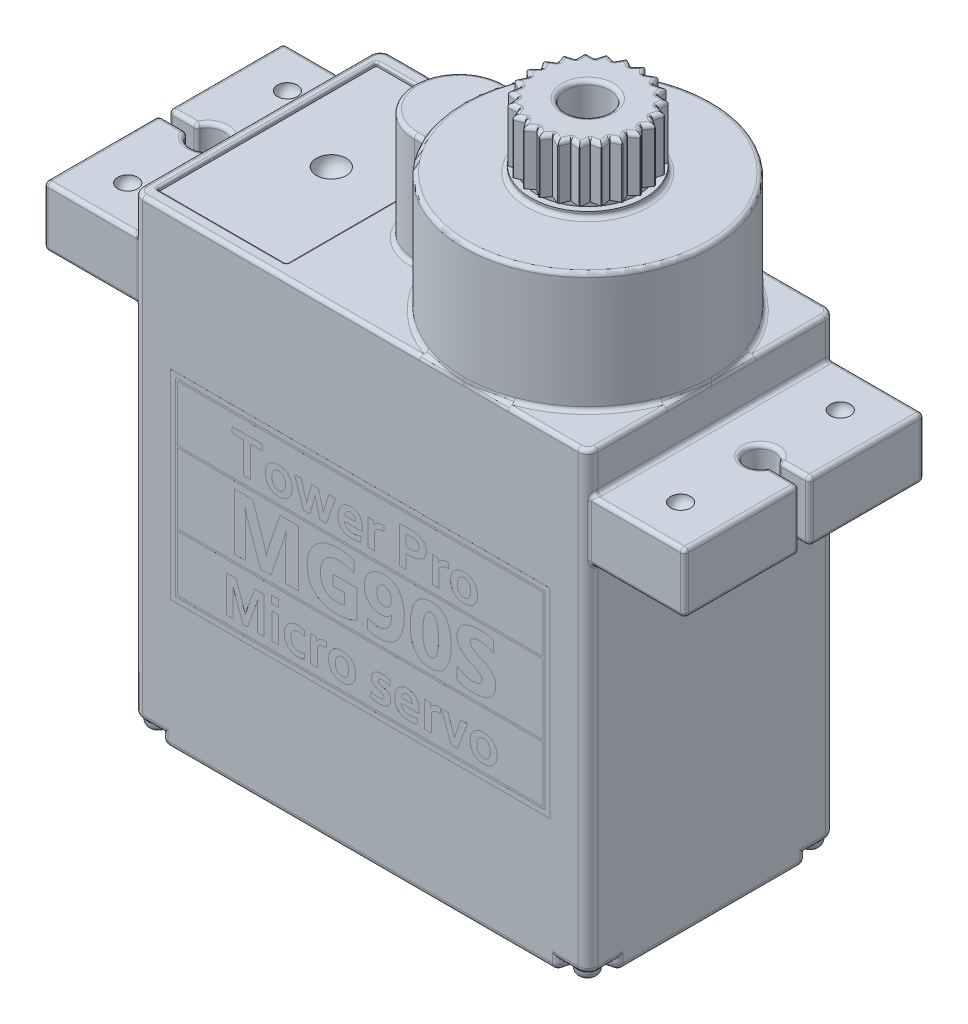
SolidWorks part; units mm, degrees
ref_plane "Plano frontal" through (0, 0, 0) normal (0, 0, 1) x (1, 0, 0)
ref_plane "Plano superior" through (0, 0, 0) normal (0, 1, 0) x (1, 0, 0)
ref_plane "Plano direito" through (0, 0, 0) normal (1, 0, 0) x (0, 0, -1)
sketch "Esboço1" plane through (0, 0, 0) normal (0, 1, 0) x (1, 0, 0)
  line L1 (-11.4, 6.2) -> (11.4, 6.2)
  line L2 (-11.4, 6.2) -> (-11.4, -6.2)
  line L3 (-11.4, -6.2) -> (11.4, -6.2)
  line L4 (11.4, 6.2) -> (11.4, -6.2)
  line L5 (-11.4, 6.2) -> (11.4, -6.2) construction
  line L6 (-11.4, -6.2) -> (11.4, 6.2) construction
  point P0 (0, 0)
  dimension "D1" = 22.8
  dimension "D2" = 12.4
extrude "Ressalto-extrusão1" add sketch "Esboço1" along normal blind 22.8
ref_plane "Plano1" through (0, 17.8, 0) normal (0, 1, 0) x (1, 0, 0)
sketch "Esboço3" plane through (0, 17.8, 0) normal (0, 1, 0) x (1, 0, 0)
  line L1 (-16.05, 6) -> (16.05, 6)
  line L2 (-16.05, 6) -> (-16.05, -6)
  line L3 (-16.05, -6) -> (16.05, -6)
  line L4 (16.05, 6) -> (16.05, -6)
  line L5 (-16.05, 6) -> (16.05, -6) construction
  line L6 (-16.05, -6) -> (16.05, 6) construction
  point P0 (0, 0)
  dimension "D1" = 32.1
  dimension "D2" = 12
extrude "Ressalto-extrusão2" add sketch "Esboço3" along normal blind 3
sketch "Esboço4" plane through (0, 22.8, 0) normal (0, 1, 0) x (1, 0, 0)
  line L4 (0, 0) -> (13.7593, 0) construction
  line L5 (-1.1595, -2.325) -> (-0.5476, -2.325)
  line L6 (-1.1595, 2.175) -> (-0.606, 2.175)
  line L7 (11.4, -6.2) -> (11.4, 6.2) construction
  line L8 (-11.4, -6.2) -> (11.4, -6.2) construction
  arc A2 (-1.1595, 2.175) -> (-1.1595, -2.325) centre (-1.1595, -0.075) ccw
  arc A3 (-0.5476, -2.325) -> (-0.606, 2.175) centre (5.2, 0) ccw
  dimension "D1" = 6.2
  dimension "D2" = 4.5
extrude "Ressalto-extrusão3" add sketch "Esboço4" along normal blind 6
sketch "Esboço5" plane through (0, 20.8, 0) normal (0, 1, 0) x (1, 0, 0)
  line L0 (0, 0) -> (0, 18.869) construction
  line L1 (-13.85, 0) -> (17.8281, 0) construction
  line L2 (-14.6438, 0.25) -> (-16.2215, 0.25)
  line L4 (-14.6438, -0.25) -> (-16.2215, -0.25)
  line L5 (-16.2215, 0.25) -> (-16.2215, -0.25)
  line L6 (-13.1431, 0.25) -> (-16.2215, -0.25) construction
  line L7 (-13.1431, -0.25) -> (-16.2215, 0.25) construction
  line L9 (14.5237, 0.25) -> (16.5205, 0.25)
  line L11 (14.5237, -0.25) -> (16.5205, -0.25)
  line L12 (16.5205, 0.25) -> (16.5205, -0.25)
  line L13 (14.0028, 0.25) -> (16.5205, -0.25) construction
  line L14 (14.0028, -0.25) -> (16.5205, 0.25) construction
  arc A0 (-14.6438, -0.25) -> (-14.6438, 0.25) centre (-13.85, 0) ccw
  arc A1 (14.5237, 0.25) -> (14.5237, -0.25) centre (13.85, 0) ccw
  point P1 (15.2616, 0)
  point P7 (-14.6823, 0)
  dimension "D1" = 27.7
  dimension "D2" = 0.5
  dimension "D3" = 0.5
extrude "Corte-extrusão1" cut sketch "Esboço5" against normal blind 7
sketch "Esboço6" plane through (0, 28.8, 0) normal (0, 1, 0) x (1, 0, 0)
  circle A0 centre (5.2, 0) radius 2.85
  dimension "D1" = 5.7
extrude "Ressalto-extrusão4" add sketch "Esboço6" along normal blind 0.5
sketch "Esboço7" plane through (0, 29.3, 0) normal (0, 1, 0) x (1, 0, 0)
  line L0 (5.2, 0) -> (5.2, 3.9708) construction
  line L1 (5.2, 2.8452) -> (5.222, 2.8452)
  line L2 (5.2, 2.8452) -> (5.178, 2.8452)
  line L3 (5.2, 0) -> (7.2989, 0) construction
  line L4 (5.178, 2.8452) -> (4.8598, 2.527)
  line L5 (5.222, 2.8452) -> (5.5402, 2.527)
  line L6 (5.9465, 2.7457) -> (5.5542, 2.5251)
  line L7 (5.9888, 2.7338) -> (6.2094, 2.3416)
  line L8 (5.9676, 2.7397) -> (5.9465, 2.7457)
  line L9 (5.9676, 2.7397) -> (5.9888, 2.7338)
  line L10 (6.6595, 2.4425) -> (6.2223, 2.3359)
  line L11 (6.6971, 2.4196) -> (6.8037, 1.9824)
  line L12 (6.6783, 2.431) -> (6.6595, 2.4425)
  line L13 (6.6783, 2.431) -> (6.6971, 2.4196)
  line L14 (7.2644, 1.9581) -> (6.8147, 1.9735)
  line L15 (7.2944, 1.926) -> (7.2791, 1.4762)
  line L16 (7.2794, 1.942) -> (7.2644, 1.9581)
  line L17 (7.2794, 1.942) -> (7.2944, 1.926)
  line L18 (7.7161, 1.3285) -> (7.2872, 1.4647)
  line L19 (7.7364, 1.2895) -> (7.6002, 0.8605)
  line L20 (7.7262, 1.309) -> (7.7161, 1.3285)
  line L21 (7.7262, 1.309) -> (7.7364, 1.2895)
  line L22 (7.9813, 0.6004) -> (7.605, 0.8472)
  line L23 (7.9902, 0.5573) -> (7.7434, 0.1811)
  line L24 (7.9857, 0.5789) -> (7.9813, 0.6004)
  line L25 (7.9857, 0.5789) -> (7.9902, 0.5573)
  line L26 (8.0401, -0.1722) -> (7.7444, 0.167)
  line L27 (8.0371, -0.2161) -> (7.6979, -0.5119)
  line L28 (8.0386, -0.1942) -> (8.0401, -0.1722)
  line L29 (8.0386, -0.1942) -> (8.0371, -0.2161)
  line L30 (7.8883, -0.9321) -> (7.6951, -0.5257)
  line L31 (7.8736, -0.9735) -> (7.4672, -1.1668)
  line L32 (7.881, -0.9528) -> (7.8883, -0.9321)
  line L33 (7.881, -0.9528) -> (7.8736, -0.9735)
  line L34 (7.5372, -1.6228) -> (7.4607, -1.1794)
  line L35 (7.5118, -1.6588) -> (7.0683, -1.7352)
  line L36 (7.5245, -1.6408) -> (7.5372, -1.6228)
  line L37 (7.5245, -1.6408) -> (7.5118, -1.6588)
  line L38 (7.0127, -2.1932) -> (7.0587, -1.7456)
  line L39 (6.9785, -2.221) -> (6.5309, -2.175)
  line L40 (6.9956, -2.2071) -> (7.0127, -2.1932)
  line L41 (6.9956, -2.2071) -> (6.9785, -2.221)
  line L42 (6.3537, -2.6009) -> (6.5188, -2.1823)
  line L43 (6.3134, -2.6185) -> (5.8947, -2.4534)
  line L44 (6.3335, -2.6097) -> (6.3537, -2.6009)
  line L45 (6.3335, -2.6097) -> (6.3134, -2.6185)
  line L46 (5.6092, -2.8157) -> (5.8811, -2.4572)
  line L47 (5.5656, -2.8217) -> (5.2071, -2.5498)
  line L48 (5.5874, -2.8187) -> (5.6092, -2.8157)
  line L49 (5.5874, -2.8187) -> (5.5656, -2.8217)
  line L50 (4.8344, -2.8217) -> (5.1929, -2.5498)
  line L51 (4.7908, -2.8157) -> (4.5189, -2.4572)
  line L52 (4.8126, -2.8187) -> (4.8344, -2.8217)
  line L53 (4.8126, -2.8187) -> (4.7908, -2.8157)
  line L54 (4.0866, -2.6185) -> (4.5053, -2.4534)
  line L55 (4.0463, -2.6009) -> (3.8812, -2.1823)
  line L56 (4.0665, -2.6097) -> (4.0866, -2.6185)
  line L57 (4.0665, -2.6097) -> (4.0463, -2.6009)
  line L58 (3.4215, -2.221) -> (3.8691, -2.175)
  line L59 (3.3873, -2.1932) -> (3.3413, -1.7456)
  line L60 (3.4044, -2.2071) -> (3.4215, -2.221)
  line L61 (3.4044, -2.2071) -> (3.3873, -2.1932)
  line L62 (2.8882, -1.6588) -> (3.3317, -1.7352)
  line L63 (2.8628, -1.6228) -> (2.9393, -1.1794)
  line L64 (2.8755, -1.6408) -> (2.8882, -1.6588)
  line L65 (2.8755, -1.6408) -> (2.8628, -1.6228)
  line L66 (2.5264, -0.9735) -> (2.9328, -1.1668)
  line L67 (2.5117, -0.9321) -> (2.7049, -0.5257)
  line L68 (2.519, -0.9528) -> (2.5264, -0.9735)
  line L69 (2.519, -0.9528) -> (2.5117, -0.9321)
  line L70 (2.3629, -0.2161) -> (2.7021, -0.5119)
  line L71 (2.3599, -0.1722) -> (2.6556, 0.167)
  line L72 (2.3614, -0.1942) -> (2.3629, -0.2161)
  line L73 (2.3614, -0.1942) -> (2.3599, -0.1722)
  line L74 (2.4098, 0.5573) -> (2.6566, 0.1811)
  line L75 (2.4187, 0.6004) -> (2.795, 0.8472)
  line L76 (2.4143, 0.5789) -> (2.4098, 0.5573)
  line L77 (2.4143, 0.5789) -> (2.4187, 0.6004)
  line L78 (2.6636, 1.2895) -> (2.7998, 0.8605)
  line L79 (2.6839, 1.3285) -> (3.1128, 1.4647)
  line L80 (2.6738, 1.309) -> (2.6636, 1.2895)
  line L81 (2.6738, 1.309) -> (2.6839, 1.3285)
  line L82 (3.1056, 1.926) -> (3.1209, 1.4762)
  line L83 (3.1356, 1.9581) -> (3.5853, 1.9735)
  line L84 (3.1206, 1.942) -> (3.1056, 1.926)
  line L85 (3.1206, 1.942) -> (3.1356, 1.9581)
  line L86 (3.7029, 2.4196) -> (3.5963, 1.9824)
  line L87 (3.7405, 2.4425) -> (4.1777, 2.3359)
  line L88 (3.7217, 2.431) -> (3.7029, 2.4196)
  line L89 (3.7217, 2.431) -> (3.7405, 2.4425)
  line L90 (4.4112, 2.7338) -> (4.1906, 2.3416)
  line L91 (4.4535, 2.7457) -> (4.8458, 2.5251)
  line L92 (4.4324, 2.7397) -> (4.4112, 2.7338)
  line L93 (4.4324, 2.7397) -> (4.4535, 2.7457)
  circle A1 centre (5.2, 0) radius 1.1
  arc A2 (2.7021, -0.5119) -> (2.7049, -0.5257) centre (5.2, 0) ccw
  arc A3 (2.6566, 0.1811) -> (2.6556, 0.167) centre (5.2, 0) ccw
  arc A4 (2.7998, 0.8605) -> (2.795, 0.8472) centre (5.2, 0) ccw
  arc A5 (4.8598, 2.527) -> (4.8458, 2.5251) centre (5.2, 0) ccw
  arc A6 (5.5542, 2.5251) -> (5.5402, 2.527) centre (5.2, 0) ccw
  arc A7 (6.2223, 2.3359) -> (6.2094, 2.3416) centre (5.2, 0) ccw
  arc A8 (6.8147, 1.9735) -> (6.8037, 1.9824) centre (5.2, 0) ccw
  arc A9 (7.2872, 1.4647) -> (7.2791, 1.4762) centre (5.2, 0) ccw
  arc A10 (7.605, 0.8472) -> (7.6002, 0.8605) centre (5.2, 0) ccw
  arc A11 (7.7444, 0.167) -> (7.7434, 0.1811) centre (5.2, 0) ccw
  arc A12 (7.6951, -0.5257) -> (7.6979, -0.5119) centre (5.2, 0) ccw
  arc A13 (7.4607, -1.1794) -> (7.4672, -1.1668) centre (5.2, 0) ccw
  arc A14 (7.0587, -1.7456) -> (7.0683, -1.7352) centre (5.2, 0) ccw
  arc A15 (6.5188, -2.1823) -> (6.5309, -2.175) centre (5.2, 0) ccw
  arc A16 (5.8811, -2.4572) -> (5.8947, -2.4534) centre (5.2, 0) ccw
  arc A17 (5.1929, -2.5498) -> (5.2071, -2.5498) centre (5.2, 0) ccw
  arc A18 (4.5053, -2.4534) -> (4.5189, -2.4572) centre (5.2, 0) ccw
  arc A19 (3.8691, -2.175) -> (3.8812, -2.1823) centre (5.2, 0) ccw
  arc A20 (3.3317, -1.7352) -> (3.3413, -1.7456) centre (5.2, 0) ccw
  arc A21 (2.9328, -1.1668) -> (2.9393, -1.1794) centre (5.2, 0) ccw
  arc A22 (4.1906, 2.3416) -> (4.1777, 2.3359) centre (5.2, 0) ccw
  arc A23 (3.5963, 1.9824) -> (3.5853, 1.9735) centre (5.2, 0) ccw
  arc A24 (3.1209, 1.4762) -> (3.1128, 1.4647) centre (5.2, 0) ccw
  dimension "D1" = 2.2
  dimension "D2" = 23
  dimension "D3" = 0.022
  dimension "D4" = 2.8452
  dimension "D5" = 0.45
  dimension "D7" = 90
extrude "Ressalto-extrusão5" add sketch "Esboço7" along normal blind 2.7
sketch "Esboço8" plane through (0, 29.3, 0) normal (0, 1, 0) x (1, 0, 0)
  circle A0 centre (5.2, 0) radius 2.5498
  circle A1 centre (5.2, 0) radius 2.85 construction
  circle A2 centre (5.2, 0) radius 2.85
extrude "Corte-extrusão2" cut sketch "Esboço8" against normal blind 0.2
sketch "Esboço9" plane through (0, 28.8, 0) normal (0, 1, 0) x (1, 0, 0)
  line L0 (-1.1595, -2.325) -> (-0.5476, -2.325) construction
  line L1 (-0.606, 2.175) -> (-1.1595, 2.175) construction
  line L2 (-1.1595, -2.325) -> (-0.5476, -2.325)
  line L3 (-0.606, 2.175) -> (-1.1595, 2.175)
  arc A0 (-0.606, 2.175) -> (-0.5476, -2.325) centre (5.2, 0) ccw
  arc A1 (-1.1595, 2.175) -> (-1.1595, -2.325) centre (-1.1595, -0.075) ccw construction
  arc A2 (-1.1595, 2.175) -> (-1.1595, -2.325) centre (-1.1595, -0.075) ccw
extrude "Corte-extrusão3" cut sketch "Esboço9" against normal blind 0.4
sketch "Esboço10" plane through (0, 0, 0) normal (0, -1, 0) x (1, 0, 0)
  line L4 (11.4, -6.2) -> (11.4, 6.2)
  line L5 (11.4, 6.2) -> (-11.4, 6.2)
  line L6 (-11.4, 6.2) -> (-11.4, -6.2)
  line L7 (-11.4, -6.2) -> (11.4, -6.2)
  line L8 (11.4, -4.7) -> (11.4, 4.7)
  line L9 (9.9, 6.2) -> (-9.9, 6.2)
  line L10 (-11.4, 4.7) -> (-11.4, -4.7)
  line L11 (-9.9, -6.2) -> (9.9, -6.2)
  arc A0 (-11.4, 4.7) -> (-9.9, 6.2) centre (-11.4, 6.2) ccw
  arc A1 (-9.9, -6.2) -> (-11.4, -4.7) centre (-11.4, -6.2) ccw
  arc A2 (11.4, -4.7) -> (9.9, -6.2) centre (11.4, -6.2) ccw
  arc A3 (9.9, 6.2) -> (11.4, 4.7) centre (11.4, 6.2) ccw
  dimension "D1" = 3
  dimension "D2" = 3
  dimension "D3" = 3
  dimension "D4" = 3
  dimension "D5" = 0
extrude "Ressalto-extrusão6" add sketch "Esboço10" along normal blind 0.5
sketch "Esboço11" plane through (0, 22.8, 0) normal (0, 1, 0) x (1, 0, 0)
  line L0 (0, 0) -> (-21.6987, 0) construction
  line L1 (-4.4, 5.5) -> (-10.9, 5.5)
  line L2 (-4.4, 5.5) -> (-4.4, -5.5)
  line L3 (-4.4, -5.5) -> (-10.9, -5.5)
  line L4 (-10.9, 5.5) -> (-10.9, -5.5)
  line L5 (-4.4, 5.5) -> (-10.9, -5.5) construction
  line L6 (-4.4, -5.5) -> (-10.9, 5.5) construction
  line L7 (-11.4, 6.2) -> (-11.4, -6.2) construction
  point P0 (-7.65, 0)
  dimension "D1" = 6.5
  dimension "D2" = 0.5
  dimension "D3" = 11
extrude "Corte-extrusão5" cut sketch "Esboço11" against normal blind 0.2
sketch "Esboço12" plane through (0, 22.6, 0) normal (0, 1, 0) x (1, 0, 0)
  line L0 (-4.4, -5.5) -> (-4.4, 5.5) construction
  line L1 (-10.9, -5.5) -> (-4.4, -5.5) construction
  line L2 (-5.1466, 0) -> (-9.5067, 0) construction
  line L3 (-8.4, 0) -> (-6.9, 0)
  arc A0 (-8.4, 0) -> (-6.9, 0) centre (-7.65, 0) ccw
  dimension "D1" = 1.5
  dimension "D2" = 3.25
  dimension "D3" = 5.5
revolve "Corte-Revolução1" cut sketch "Esboço12" angle 360 about L2
sketch "Esboço13" plane through (0, 20.8, 0) normal (0, 1, 0) x (1, 0, 0)
  line L0 (-13.85, 0) -> (-13.85, -5.7142) construction
  line L1 (-13.85, 0) -> (-13.85, 3.0965) construction
  line L2 (-11.4, 6) -> (-16.05, 6) construction
  line L3 (-13.85, 0) -> (-18.9376, 0) construction
  line L4 (-13.85, 3.0965) -> (-13.85, 5.8446) construction
  line L5 (-13.85, 4.5) -> (-13.85, 3.5)
  line L6 (-13.85, -3.5) -> (-13.85, -4.5)
  arc A0 (-13.85, 4.5) -> (-13.85, 3.5) centre (-13.85, 4) ccw
  arc A1 (-13.85, -4.5) -> (-13.85, -3.5) centre (-13.85, -4) cw
  dimension "D2" = 0.5
  dimension "D1" = 2
revolve "Corte-Revolução2" cut sketch "Esboço13" angle 360 about L1
mirror "Espelhar1" about plane through (0, 0, 0) normal (1, 0, 0) of "Corte-Revolução2"
fillet "Filete1" radius 0.5 4 edges at (-11.4, 11.4, -6.2) (-11.4, 11.4, 6.2) (11.4, 11.4, 6.2) (11.4, 11.4, -6.2)
fillet "Filete2" radius 0.3 28 edges at (-10.4, 0, -6.2) (-11.2536, 0, -6.0536) (-11.4, 0, 5.2) (-11.2536, 0, 6.0536) (10.4, 0, 6.2) (11.2536, 0, 6.0536) (11.4, 0, -5.2) (11.2536, 0, -6.0536) (-11.4, -0.5, 0) (-10.3393, -0.5, 5.1393) (0, -0.5, 6.2) (10.3393, -0.5, 5.1393) (11.4, -0.5, 0) (10.3393, -0.5, -5.1393) (0, -0.5, -6.2) (-10.3393, -0.5, -5.1393) (-11.4, 0, -5.2) (-10.4, 0, 6.2) (11.4, 0, 5.2) (10.4, 0, -6.2) (-9.9, -0.25, 6.2) (-11.4, -0.25, 4.7) (-11.4, -0.25, -4.7) (-9.9, -0.25, -6.2) (9.9, -0.25, -6.2) (11.4, -0.25, -4.7) (11.4, -0.25, 4.7) (9.9, -0.25, 6.2)
fillet "Filete3" radius 0.2 56 edges at (-11.3743, 20.8, -5.8581) (-11.3743, 20.8, 5.8581) (-13.675, 20.8, 6) (-11.3, 19.3, 6) (-11.3, 19.3, -6) (-13.675, 20.8, -6) (-13.675, 17.8, 6) (-11.3743, 17.8, 5.8581) (-11.4, 17.8, 0) (-11.3743, 17.8, -5.8581) (-13.675, 17.8, -6) (-15.3469, 17.8, 0.25) (-15.3469, 20.8, 0.25) (-15.3469, 20.8, -0.25) (-15.3469, 17.8, -0.25) (-13.0177, 17.8, 0) (-14.6438, 19.3, -0.25) (-13.0177, 20.8, 0) (-14.6438, 19.3, 0.25) (-16.05, 19.3, 6) (-16.05, 17.8, 3.125) (-16.05, 19.3, 0.25) (-16.05, 20.8, 3.125) (-16.05, 19.3, -6) (-16.05, 20.8, -3.125) (-16.05, 19.3, -0.25) (-16.05, 17.8, -3.125) (-11.4, 20.8, 0) (11.4, 20.8, 0) (11.3743, 20.8, 5.8581) (11.3743, 20.8, -5.8581) (16.05, 19.3, 6) (11.3, 19.3, 6) (16.05, 19.3, -6) (11.3, 19.3, -6) (11.3743, 17.8, -5.8581) (11.4, 17.8, 0) (11.3743, 17.8, 5.8581) (16.05, 17.8, 3.125) (15.2868, 17.8, 0.25) (13.1314, 17.8, 0) (15.2868, 17.8, -0.25) (16.05, 17.8, -3.125) (15.2868, 20.8, 0.25) (15.2868, 20.8, -0.25) (14.5237, 19.3, 0.25) (13.1314, 20.8, 0) (14.5237, 19.3, -0.25) (13.675, 20.8, -6) (13.675, 17.8, -6) (13.675, 17.8, 6) (13.675, 20.8, 6) (16.05, 19.3, -0.25) (16.05, 20.8, -3.125) (16.05, 20.8, 3.125) (16.05, 19.3, 0.25)
fillet "Filete4" radius 0.2 26 edges at (11.4, 22.8, -2.85) (-2.85, 22.8, -6.2) (8.05, 22.8, 6.2) (9.5841, 22.8, 4.3841) (1.6676, 22.8, -5.0953) (9.5841, 22.8, -4.3841) (-3.4095, 22.8, 0.075) (-0.8535, 22.8, 2.325) (1.7341, 22.8, 5.1408) (-0.8827, 22.8, -2.175) (5.2, 28.8, 6.2) (-0.606, 25.6, -2.175) (-0.5476, 25.6, 2.325) (-3.4095, 28.4, 0.075) (-0.8827, 28.4, -2.175) (-0.9995, 28.4, 0.0805) (-0.8535, 28.4, 2.325) (-11.4, 22.8, 0) (8.05, 22.8, -6.2) (-2.85, 22.8, 6.2) (-11.2536, 22.8, 6.0536) (-11.2536, 22.8, -6.0536) (11.4, 22.8, 2.85) (11.2536, 22.8, 6.0536) (11.2536, 22.8, -6.0536) (5.2, 28.8, 2.85)
fillet "Filete5" radius 0.1 8 edges at (-10.9, 22.8, 0) (-7.65, 22.8, 5.5) (-7.65, 22.8, -5.5) (-4.4, 22.8, 0) (-10.9, 22.7, 5.5) (-4.4, 22.7, 5.5) (-10.9, 22.7, -5.5) (-4.4, 22.7, -5.5)
sketch "Esboço15" plane through (0, 0, 6.2) normal (0, 0, 1) x (1, 0, 0)
  line L0 (0, -0.2) -> (0, 20.813) construction
  line L1 (-9.6252, -0.2) -> (9.6252, -0.2) construction
  line L2 (-15.85, 18) -> (-11.3899, 18) construction
  line L3 (-9.5, 16) -> (9.5, 16)
  line L4 (-9.5, 16) -> (-9.5, 6)
  line L5 (-9.5, 6) -> (9.5, 6)
  line L6 (9.5, 16) -> (9.5, 6)
  line L7 (-9.5, 16) -> (9.5, 6) construction
  line L8 (-9.5, 6) -> (9.5, 16) construction
  point P4 (0, 11)
  dimension "D1" = 2
  dimension "D2" = 19
  dimension "D3" = 10
extrude "Ressalto-extrusão8" add sketch "Esboço15" along normal blind 0.001
sketch "Esboço16" plane through (0, 0, 6.201) normal (0, 0, 1) x (1, 0, 0)
  line L0 (0, 0) -> (0, 21.6518) construction
  line L1 (-10.3224, 11) -> (10.3224, 11) construction
  line L2 (-9.15, 9.15) -> (-9.15, 6.35)
  line L3 (-9.25, 15.75) -> (9.25, 15.75)
  line L4 (-9.25, 15.75) -> (-9.25, 6.25)
  line L5 (-9.25, 6.25) -> (9.25, 6.25)
  line L6 (9.5, 6) -> (9.5, 16)
  line L7 (9.5, 16) -> (-9.5, 16)
  line L8 (-9.5, 16) -> (-9.5, 6)
  line L9 (-9.5, 6) -> (9.5, 6)
  line L10 (9.5, 6) -> (9.5, 16) construction
  line L11 (9.5, 16) -> (-9.5, 16) construction
  line L12 (-9.5, 16) -> (-9.5, 6) construction
  line L13 (-9.5, 6) -> (9.5, 6) construction
  line L14 (9.25, 15.75) -> (9.25, 6.25)
  line L15 (-9.25, 15.75) -> (9.25, 6.25) construction
  line L16 (-9.25, 6.25) -> (9.25, 15.75) construction
  line L17 (-9.15, 15.65) -> (9.15, 15.65)
  line L18 (-9.15, 15.65) -> (-9.15, 12.85)
  line L19 (-9.15, 6.35) -> (9.15, 6.35)
  line L20 (9.15, 15.65) -> (9.15, 12.85)
  line L21 (-9.15, 15.65) -> (9.15, 6.35) construction
  line L22 (-9.15, 6.35) -> (9.15, 15.65) construction
  line L23 (-9.15, 12.85) -> (9.15, 12.85)
  line L24 (-9.25, 12.85) -> (-9.25, 12.75)
  line L25 (-9.15, 12.75) -> (9.15, 12.75)
  line L26 (9.25, 12.85) -> (9.25, 12.75)
  line L27 (-9.15, 9.25) -> (9.15, 9.25)
  line L28 (-9.25, 9.25) -> (-9.25, 9.15)
  line L29 (-9.15, 9.15) -> (9.15, 9.15)
  line L30 (9.25, 9.25) -> (9.25, 9.15)
  line L31 (-9.15, 12.75) -> (-9.15, 9.25)
  line L32 (9.15, 12.75) -> (9.15, 9.25)
  line L33 (9.15, 9.15) -> (9.15, 6.35)
  point P7 (0, 11)
  point P15 (0, 11)
  dimension "D2" = 18.5
  dimension "D3" = 9.5
  dimension "D4" = 0.1
  dimension "D5" = 0.1
  dimension "D6" = 0.1
  dimension "D7" = 0.1
  dimension "D8" = 3.5
  dimension "D1" = 0
extrude "Corte-extrusão6" cut sketch "Esboço16" against normal blind 0.0001 contours L14 L3 L4 L5 L23 L18 L17 L20 L25 L32 L27 L31 L29 L33 L19 L2
sketch "Esboço17" plane through (0, 0, 6.201) normal (0, 0, 1) x (1, 0, 0)
  text T0 "MG90S" font "Gadugi" height in points 11
extrude "Corte-extrusão7" cut sketch "Esboço17" against normal blind 0.0001
sketch "Esboço18" plane through (0, 0, 6.201) normal (0, 0, 1) x (1, 0, 0)
  text T0 "Micro servo" font "Corbel" height in points 7
extrude "Ressalto-extrusão9" add sketch "Esboço18" along normal blind 0.0001
fillet "Filete7" radius 0.2 70 edges at (5.2, 32, 1.1) (5.3811, 32, -2.6861) (5.5472, 32, -2.5261) (5.7503, 32, -2.6354) (6.0991, 32, -2.5377) (6.2159, 32, -2.3387) (6.4409, 32, -2.3892) (6.7504, 32, -2.201) (6.8092, 32, -1.9779) (7.0395, 32, -1.9658) (7.2867, 32, -1.7011) (7.2831, 32, -1.4704) (7.5017, 32, -1.3966) (7.6683, 32, -1.075) (7.6026, 32, -0.8539) (7.7931, 32, -0.7238) (7.8668, 32, -0.3692) (7.7439, 32, -0.174) (7.8922, 32, 0.0026) (7.8675, 32, 0.364) (7.6965, 32, 0.5188) (7.7917, 32, 0.7289) (7.6704, 32, 1.0702) (7.464, 32, 1.1731) (7.4989, 32, 1.4011) (7.2901, 32, 1.697) (7.0635, 32, 1.7404) (7.0357, 32, 1.9694) (6.7547, 32, 2.198) (6.5249, 32, 2.1786) (6.4363, 32, 2.3916) (6.1041, 32, 2.5359) (5.8879, 32, 2.4553) (5.7452, 32, 2.6365) (5.3864, 32, 2.6858) (5.2, 32, 2.5498) (5.0136, 32, 2.6858) (4.6548, 32, 2.6365) (4.5121, 32, 2.4553) (4.2959, 32, 2.5359) (3.9637, 32, 2.3916) (3.8751, 32, 2.1786) (3.6453, 32, 2.198) (3.3643, 32, 1.9694) (3.3365, 32, 1.7404) (3.1099, 32, 1.697) (2.9011, 32, 1.4011) (2.936, 32, 1.1731) (2.7296, 32, 1.0702) (2.6083, 32, 0.7289) (2.7035, 32, 0.5188) (2.5325, 32, 0.364) (2.5078, 32, 0.0026) (2.6561, 32, -0.174) (2.5332, 32, -0.3692) (2.6069, 32, -0.7238) (2.7974, 32, -0.8539) (2.7317, 32, -1.075) (2.8983, 32, -1.3966) (4.8528, 32, -2.5261) (3.1169, 32, -1.4704) (5.0189, 32, -2.6861) (3.1133, 32, -1.7011) (3.3605, 32, -1.9658) (3.5908, 32, -1.9779) (3.6496, 32, -2.201) (3.9591, 32, -2.3892) (4.1841, 32, -2.3387) (4.3009, 32, -2.5377) (4.6497, 32, -2.6354)
mirror "Espelhar3" about plane through (0, 0, 0) normal (0, 0, 1) of "Corte-extrusão6", "Ressalto-extrusão8"
sketch "Esboço19" plane through (0, 0, -6.201) normal (0, 0, -1) x (-1, 0, 0)
  text T0 "MG90S" font "Gadugi" height in points 11
  text T1 "Micro servo" font "Corbel" height in points 7
  text T2 "Tower Pro" font "Corbel" height in points 7
extrude "Corte-extrusão8" cut sketch "Esboço19" against normal blind 0.0001
sketch "Esboço20" plane through (0, 0, 6.201) normal (0, 0, 1) x (1, 0, 0)
  text T0 "Tower Pro" font "Corbel" height in points 7
extrude "Corte-extrusão9" cut sketch "Esboço20" against normal blind 0.0001
sketch "Esboço21" plane through (0, 0, 0) normal (0, -1, 0) x (1, 0, 0)
  line L0 (0, 0) -> (0, -2.1699) construction
  line L1 (0, 0) -> (-3.2385, 0) construction
  circle A0 centre (10.7537, -5.5708) radius 0.5
  circle A2 centre (-10.7537, -5.5708) radius 0.5
  circle A3 centre (-10.7537, 5.5708) radius 0.5
  circle A4 centre (10.7537, 5.5708) radius 0.5
  dimension "D1" = 1
extrude "Ressalto-extrusão13" add sketch "Esboço21" along normal blind 0.4
fillet "Filete8" radius 0.3 4 edges at (-10.7537, -0.4, 5.0708) (-10.7537, -0.4, -5.0708) (10.7537, -0.4, -6.0708) (10.7537, -0.4, 6.0708)
sketch "Esboço22" plane through (0, -0.4, 0) normal (0, -1, 0) x (1, 0, 0)
  line L0 (10.6537, -5.6708) -> (10.4537, -5.6708)
  line L1 (10.8537, -5.8708) -> (10.6537, -5.8708)
  line L2 (10.8537, -5.8708) -> (10.8537, -5.6708)
  line L3 (10.8537, -5.2708) -> (10.6537, -5.2708)
  line L4 (10.6537, -5.8708) -> (10.6537, -5.6708)
  line L5 (10.8537, -5.8708) -> (10.6537, -5.2708) construction
  line L6 (10.8537, -5.2708) -> (10.6537, -5.8708) construction
  line L7 (11.0537, -5.6708) -> (10.8537, -5.6708)
  line L8 (11.0537, -5.6708) -> (11.0537, -5.4708)
  line L9 (11.0537, -5.4708) -> (10.8537, -5.4708)
  line L10 (10.4537, -5.6708) -> (10.4537, -5.4708)
  line L11 (11.0537, -5.6708) -> (10.4537, -5.4708) construction
  line L12 (11.0537, -5.4708) -> (10.4537, -5.6708) construction
  line L13 (10.6537, -5.4708) -> (10.6537, -5.2708)
  line L14 (10.6537, -5.4708) -> (10.4537, -5.4708)
  line L15 (10.8537, -5.4708) -> (10.8537, -5.2708)
  point P0 (10.7537, -5.5708)
  point P6 (10.7537, -5.5708)
  dimension "D1" = 0.6
  dimension "D2" = 0.6
  dimension "D3" = 0.2
  dimension "D4" = 0.2
extrude "Corte-extrusão10" cut sketch "Esboço22" against normal blind 0.15
mirror "Espelhar6" about plane through (0, 0, 0) normal (1, 0, 0) of "Corte-extrusão10"
mirror "Espelhar7" about plane through (0, 0, 0) normal (0, 0, 1) of "Espelhar6", "Corte-extrusão10"
fillet "Filete9" radius 0.01 80 edges at (10.6171, -0.4, -5.4708) (10.6171, -0.4, -5.6708) (10.6537, -0.4, -5.7075) (10.8537, -0.4, -5.7075) (10.8903, -0.4, -5.6708) (10.8903, -0.4, -5.4708) (10.8537, -0.4, -5.4342) (10.6537, -0.4, -5.4342) (10.8903, -0.4, 5.6708) (10.8903, -0.4, 5.4708) (10.8537, -0.4, 5.7075) (10.6537, -0.4, 5.7075) (10.6171, -0.4, 5.6708) (10.6171, -0.4, 5.4708) (10.6537, -0.4, 5.4342) (10.8537, -0.4, 5.4342) (-10.8903, -0.4, 5.6708) (-10.8537, -0.4, 5.4342) (-10.8903, -0.4, 5.4708) (-10.8537, -0.4, 5.7075) (-10.6537, -0.4, 5.7075) (-10.6171, -0.4, 5.6708) (-10.6171, -0.4, 5.4708) (-10.6537, -0.4, 5.4342) (-10.6171, -0.4, -5.6708) (-10.6537, -0.4, -5.4342) (-10.8903, -0.4, -5.4708) (-10.8537, -0.4, -5.7075) (-10.6537, -0.4, -5.7075) (-10.6171, -0.4, -5.4708) (-10.8537, -0.4, -5.4342) (-10.8903, -0.4, -5.6708)
